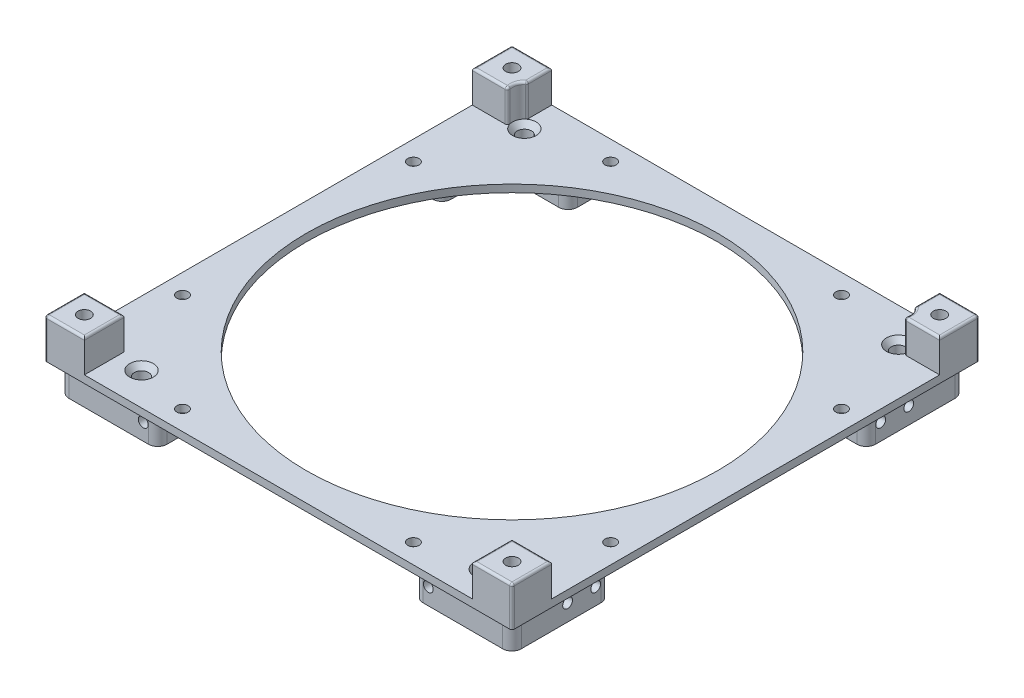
SolidWorks part; units mm, degrees
ref_plane "Front Plane" through (0, 0, 0) normal (0, 0, 1) x (1, 0, 0)
ref_plane "Top Plane" through (0, 0, 0) normal (0, 1, 0) x (1, 0, 0)
ref_plane "Right Plane" through (0, 0, 0) normal (1, 0, 0) x (0, 0, -1)
sketch "Sketch2" plane through (0, 0, 0) normal (0, 1, 0) x (1, 0, 0)
  line L1 (-50, 50) -> (50, 50)
  line L2 (-50, 50) -> (-50, -50)
  line L3 (-50, -50) -> (50, -50)
  line L4 (50, 50) -> (50, -50)
  point P4 (0, 50)
  point P6 (-50, 0)
  dimension "D1" = 100
  dimension "D2" = 100
extrude "Boss-Extrude1" add sketch "Sketch2" along normal blind 1.6
sketch "Sketch3" plane through (0, 0, 0) normal (0, 1, 0) x (1, 0, 0)
  line L1 (-50, 50) -> (-41.5, 50)
  line L2 (-50, 50) -> (-50, 41.5)
  line L3 (-50, 41.5) -> (-41.5, 41.5)
  line L4 (-41.5, 50) -> (-41.5, 41.5)
  line L5 (50, 50) -> (41.5, 50)
  line L6 (50, 50) -> (50, 41.5)
  line L7 (50, 41.5) -> (41.5, 41.5)
  line L8 (41.5, 50) -> (41.5, 41.5)
  line L9 (-50, -50) -> (-41.5, -50)
  line L10 (-50, -50) -> (-50, -41.5)
  line L11 (-50, -41.5) -> (-41.5, -41.5)
  line L12 (-41.5, -50) -> (-41.5, -41.5)
  line L13 (50, -50) -> (41.5, -50)
  line L14 (50, -50) -> (50, -41.5)
  line L15 (50, -41.5) -> (41.5, -41.5)
  line L16 (41.5, -50) -> (41.5, -41.5)
  dimension "D1" = 8.5
extrude "Boss-Extrude2" add sketch "Sketch3" along normal blind 8.5
sketch "Sketch4" plane through (0, 0, 0) normal (0, -1, 0) x (1, 0, 0)
  line L0 (27.4, 48.4) -> (48.4, 48.4)
  line L3 (45.4, 45.4) -> (27.4, 45.4)
  line L4 (27.4, 48.4) -> (27.4, 45.4)
  line L7 (48.4, 27.4) -> (45.4, 27.4)
  line L8 (45.4, 45.4) -> (45.4, 27.4)
  line L9 (48.4, 48.4) -> (48.4, 27.4)
  line L10 (50, 50) -> (50, -50) construction
  line L11 (-50, 50) -> (50, 50) construction
  line L12 (48.4, -48.4) -> (27.4, -48.4)
  line L13 (48.4, -27.4) -> (45.4, -27.4)
  line L14 (48.4, -27.4) -> (48.4, -48.4)
  line L16 (45.4, -27.4) -> (45.4, -45.4)
  line L19 (45.4, -45.4) -> (27.4, -45.4)
  line L20 (27.4, -48.4) -> (27.4, -45.4)
  line L21 (50, -50) -> (-50, -50) construction
  dimension "D1" = 21
  dimension "D2" = 3
  dimension "D3" = 1.6
  dimension "D4" = 1.6
  dimension "D5" = 1.6
extrude "Boss-Extrude3" add sketch "Sketch4" along normal blind 6
sketch "Sketch51" plane through (0, 0, 0) normal (0, 1, 0) x (1, 0, 0)
  circle A0 centre (0, 0) radius 44
  dimension "D1" = 88
extrude "Cut-Extrude1" cut sketch "Sketch51" along normal up to surface (1.6 mm away)
fillet "Fillet5" radius 0.5 4 edges at (-50, 4.25, 50) (-50, 4.25, -50) (50, 4.25, -50) (50, 4.25, 50)
mirror "Mirror1" about plane through (0, 0, 0) normal (1, 0, 0) of "Boss-Extrude3"
sketch "Sketch53" plane through (0, 0, 0) normal (0, -1, 0) x (1, 0, 0)
  line L0 (-27.4, -45.4) -> (-45.4, -45.4)
  line L18 (-27.4, -45.4) -> (-27.4, -39.4)
  line L19 (-42.4, -39.4) -> (-27.4, -39.4)
  line L35 (-45.4, -45.4) -> (-45.4, -27.4)
  line L36 (-42.4, 39.4) -> (-27.4, 39.4)
  line L37 (-42.4, -39.4) -> (-42.4, -27.4)
  line L38 (-45.4, -27.4) -> (-42.4, -27.4)
  line L40 (-27.4, 39.4) -> (-27.4, 45.4)
  line L45 (42.4, 39.4) -> (27.4, 39.4)
  line L48 (42.4, -39.4) -> (42.4, -27.4)
  line L51 (27.4, 39.4) -> (27.4, 45.4)
  line L57 (42.4, 39.4) -> (42.4, 27.4)
  line L65 (-45.4, 27.4) -> (-42.4, 27.4)
  line L66 (-42.4, 39.4) -> (-42.4, 27.4)
  line L67 (-27.4, 45.4) -> (-45.4, 45.4)
  line L68 (27.4, -45.4) -> (27.4, -39.4)
  line L70 (27.4, -39.4) -> (42.4, -39.4)
  line L71 (-45.4, 45.4) -> (-45.4, 27.4)
  line L76 (27.4, 45.4) -> (45.4, 45.4)
  line L77 (45.4, 45.4) -> (45.4, 27.4)
  line L78 (45.4, 27.4) -> (42.4, 27.4)
  line L81 (42.4, -27.4) -> (45.4, -27.4)
  line L82 (45.4, -27.4) -> (45.4, -45.4)
  line L83 (45.4, -45.4) -> (27.4, -45.4)
  dimension "D1" = 6
  dimension "D3" = 3
  dimension "D4" = 3
extrude "Boss-Extrude4" add sketch "Sketch53" along normal up to surface (6 mm away)
fillet "Fillet4" radius 2 20 edges at (-48.4, -3, 27.4) (-48.4, -3, -27.4) (48.4, -3, 27.4) (48.4, -3, -27.4) (27.4, -3, -48.4) (27.4, -3, 48.4) (-27.4, -3, 48.4) (-27.4, -3, -48.4) (42.4, -3, -27.4) (42.4, -3, 27.4) (-42.4, -3, 27.4) (-42.4, -3, -27.4) (27.4, -3, 39.4) (27.4, -3, -39.4) (-27.4, -3, -39.4) (-27.4, -3, 39.4) (-48.4, -3, -48.4) (-48.4, -3, 48.4) (48.4, -3, 48.4) (48.4, -3, -48.4)
sketch "Sketch52" plane through (0, 0, 0) normal (0, 1, 0) x (1, 0, 0)
  line L0 (48.4, -29.4) -> (48.4, -46.4) construction
  line L2 (48.4, -29.4) -> (48.4, -46.4) construction
  line L3 (46.4, -48.4) -> (29.4, -48.4) construction
  line L4 (48.4, 46.4) -> (48.4, 29.4) construction
  line L5 (48.4, 46.4) -> (48.4, 29.4) construction
  point P0 (39.975, 42.685)
  point P1 (-40.035, 42.685)
  point P2 (-36.225, -43.045)
  point P3 (37.435, -43.045)
hole_wizard "CSK for #3 Flat Head Machine Screw1" positions "Sketch59" profile "Sketch60" countersink size "#3" standard "ANSI Inch"
sketch "Sketch59" plane through (0, 1.6, 0) normal (0, 1, 0) x (1, 0, 0)
  point P19 (37.435, -43.045)
  point P24 (-40.035, 42.685)
  point P27 (39.975, 42.685)
  point P31 (-36.225, -43.045)
sketch "Sketch60" plane through (37.435, 1.6, 43.045) normal (1, 0, 0) x (0, 0, 1)
  line L0 (0, 0) -> (0, 8.5147)
  line L1 (0, 8.5147) -> (1.524, 7.599)
  line L2 (1.524, 7.599) -> (1.524, 1.1542)
  line L3 (1.524, 1.1542) -> (2.5273, 0)
  line L5 (2.5273, 0) -> (0, 0)
  line L6 (-1.524, 1.1542) -> (-2.5273, 0) construction
  line L10 (0, 8.5147) -> (-1.524, 7.599) construction
  line L11 (0, -6.35) -> (0, 107.95) construction
  dimension "Hole Dia." = 3.048
  dimension "Hole Depth" = 7.599
  dimension "Near C'Sink Dia." = 5.0546
  dimension "Near C'Sink Angle" = 82
  dimension "Drill Angle" = 118
sketch "Sketch61" plane through (0, 1.6, 0) normal (0, 1, 0) x (1, 0, 0)
  circle A0 centre (39.975, 42.685) radius 2.5273
  circle A1 centre (-40.035, 42.685) radius 2.5273
  arc A2 (41.5, 44.7003) -> (42.2073, 41.5) centre (39.975, 42.685) ccw construction
  arc A3 (-42.2673, 41.5) -> (-41.5, 44.7444) centre (-40.035, 42.685) ccw construction
extrude "Cut-Extrude2" cut sketch "Sketch61" along normal up to surface (6.9 mm away)
sketch "side-mounting-1-holes" plane through (0, 0, 0) normal (1, 0, 0) x (0, 0, -1)
  line L0 (-49.5, 0) -> (49.5, 0) construction
  line L1 (50, 8.5) -> (50, 0) construction
  point P0 (36.5, -2.45)
  point P1 (30.5, -2.45)
  dimension "D1" = 2.45
  dimension "D2" = 13.5
  dimension "D3" = 19.5
hole_wizard "Helicoil insert1" positions "Sketch48" profile "Sketch50" hole size "M2.2x0.45" standard "ANSI Metric"
sketch "Sketch48" plane through (48.4, 0, 0) normal (1, 0, 0) x (0, 0, -1)
  point P0 (36.5, -2.45)
  point P3 (30.5, -2.45)
sketch "Sketch50" plane through (48.4, -2.45, -36.5) normal (0, 1, 0) x (0, 0, -1)
  line L0 (0, 0) -> (0, 6)
  line L1 (0, 6) -> (1.05, 6)
  line L2 (1.05, 6) -> (1.05, 0)
  line L5 (1.05, 0) -> (0, 0)
  line L11 (0, -6.35) -> (0, 107.95) construction
  dimension "Thru Hole Dia." = 2.1
  dimension "Thru Hole Depth" = 6
sketch "side-mounting-2-holes" plane through (0, 0, 0) normal (0, 0, 1) x (1, 0, 0)
  line L0 (50, 8.5) -> (50, 0) construction
  line L3 (49.5, 0) -> (-49.5, 0) construction
  point P1 (30.5, -2.4475)
  dimension "D1" = 2.4475
  dimension "D2" = 19.5
hole_wizard "Helicoil insert2" positions "Sketch44" profile "Sketch46" hole size "M2.2x0.45" standard "ANSI Metric"
sketch "Sketch44" plane through (0, 0, -48.4) normal (0, 0, -1) x (-1, 0, 0)
  point P0 (-30.5, -2.4475)
sketch "Sketch46" plane through (30.5, -2.4475, -48.4) normal (1, 0, 0) x (0, 1, 0)
  line L0 (0, 0) -> (0, 9)
  line L1 (0, 9) -> (1.05, 9)
  line L2 (1.05, 9) -> (1.05, 0)
  line L5 (1.05, 0) -> (0, 0)
  line L11 (0, -6.35) -> (0, 107.95) construction
  dimension "Thru Hole Dia." = 2.1
  dimension "Thru Hole Depth" = 9
mirror "Mirror4" about plane through (0, 0, 0) normal (1, 0, 0) of "Helicoil insert2", "Helicoil insert1"
mirror "Mirror5" about plane through (0, 0, 0) normal (0, 0, 1) of "Mirror4", "Helicoil insert1", "Helicoil insert2"
sketch "top-bottom-mounting-holes" plane through (0, 0, 0) normal (0, -1, 0) x (1, 0, 0)
  line L0 (-50, -49.5) -> (-50, 49.5) construction
  line L1 (49.5, -50) -> (-49.5, -50) construction
  point P0 (-45.8, -24.7)
  point P1 (-24.7, -45.8)
  dimension "D1" = 4.2
  dimension "D2" = 4.2
  dimension "D3" = 25.3
  dimension "D4" = 25.3
hole_wizard "M2 Clearance Hole1" positions "Sketch57" profile "Sketch58" hole size "M2" standard "ANSI Metric"
sketch "Sketch57" plane through (0, 1.6, 0) normal (0, 1, 0) x (1, 0, 0)
  point P0 (-45.8, 24.7)
  point P3 (-24.7, 45.8)
sketch "Sketch58" plane through (-45.8, 1.6, -24.7) normal (1, 0, 0) x (0, 0, 1)
  line L0 (0, 0) -> (0, 1.6)
  line L1 (0, 1.6) -> (1.2, 1.6)
  line L2 (1.2, 1.6) -> (1.2, 0)
  line L5 (1.2, 0) -> (0, 0)
  line L11 (0, -6.35) -> (0, 107.95) construction
  dimension "Thru Hole Dia." = 2.4
  dimension "Thru Hole Depth" = 1.6
mirror "Mirror6" about plane through (0, 0, 0) normal (1, 0, 0) of "M2 Clearance Hole1"
mirror "Mirror7" about plane through (0, 0, 0) normal (0, 0, 1) of "Mirror6", "M2 Clearance Hole1"
fillet "Fillet6" radius 3.2 4 edges at (-42.4, -3, 39.4) (42.4, -3, 39.4) (42.4, -3, -39.4) (-42.4, -3, -39.4)
fillet "Fillet7" radius 0.5 26 edges at (41.5, 8.5, -47.3502) (45.5, 8.5, -50) (49.8536, 8.5, -49.8536) (50, 8.5, -45.5) (46.1036, 8.5, -41.5) (42.4428, 8.5, -43.2304) (-50, 8.5, -45.5) (-49.8536, 8.5, -49.8536) (-45.5, 8.5, -50) (-41.5, 8.5, -47.3722) (-42.4945, 8.5, -43.2666) (-46.1336, 8.5, -41.5) (-45.75, 8.5, 41.5) (-41.5, 8.5, 45.75) (-45.5, 8.5, 50) (-49.8536, 8.5, 49.8536) (-50, 8.5, 45.5) (41.5, 8.5, 45.75) (45.75, 8.5, 41.5) (50, 8.5, 45.5) (49.8536, 8.5, 49.8536) (45.5, 8.5, 50) (-41.5, 5.05, -44.7444) (-42.2673, 5.05, -41.5) (42.2073, 5.05, -41.5) (41.5, 5.05, -44.7003)
sketch "Sketch62" plane through (0, 8.5, 0) normal (0, 1, 0) x (1, 0, 0)
  line L0 (42, -49.5) -> (49.5, -49.5) construction
  line L1 (42, -42) -> (42, -49.5) construction
  line L2 (-49.5, 49.5) -> (-49.5, 42) construction
  line L3 (-42, 49.5) -> (-49.5, 49.5) construction
  point P0 (45.75, -45.75)
  point P4 (45.75, -49.5)
  point P7 (42, -45.75)
  point P8 (-45.75, 45.75)
  point P10 (-49.5, 45.75)
  point P13 (-45.75, 49.5)
  point P14 (45.75, 45.75)
  point P15 (-45.75, -45.75)
hole_wizard "Tap Drill for #6-32 Tap2" positions "Sketch65" profile "Sketch66" hole size "#6-32" standard "ANSI Inch"
sketch "Sketch65" plane through (0, 8.5, 0) normal (0, 1, 0) x (1, 0, 0)
  point P0 (45.75, 45.75)
  point P3 (-45.75, -45.75)
  point P6 (-45.75, 45.75)
  point P9 (45.75, -45.75)
sketch "Sketch66" plane through (45.75, 8.5, -45.75) normal (1, 0, 0) x (0, 0, 1)
  line L0 (0, 0) -> (0, 15.3117)
  line L1 (0, 15.3117) -> (1.3525, 14.499)
  line L2 (1.3525, 14.499) -> (1.3525, 0)
  line L5 (1.3525, 0) -> (0, 0)
  line L10 (0, 15.3117) -> (-1.3526, 14.499) construction
  line L11 (0, -6.35) -> (0, 107.95) construction
  dimension "Hole Dia." = 2.7051
  dimension "Hole Depth" = 14.499
  dimension "Drill Angle" = 118
equation "\"D1@Sketch52\"=7.65+3.315"
equation "\"D2@Sketch52\"=\"D1@Sketch52\"+73.66"
equation "\"D3@Sketch52\"=0.665+4.69"
equation "\"D4@Sketch52\"=\"D3@Sketch52\"+85.73"
equation "\"D5@Sketch52\"=5.11+3.315"
equation "\"D6@Sketch52\"=\"D5@Sketch52\"+80.01"
